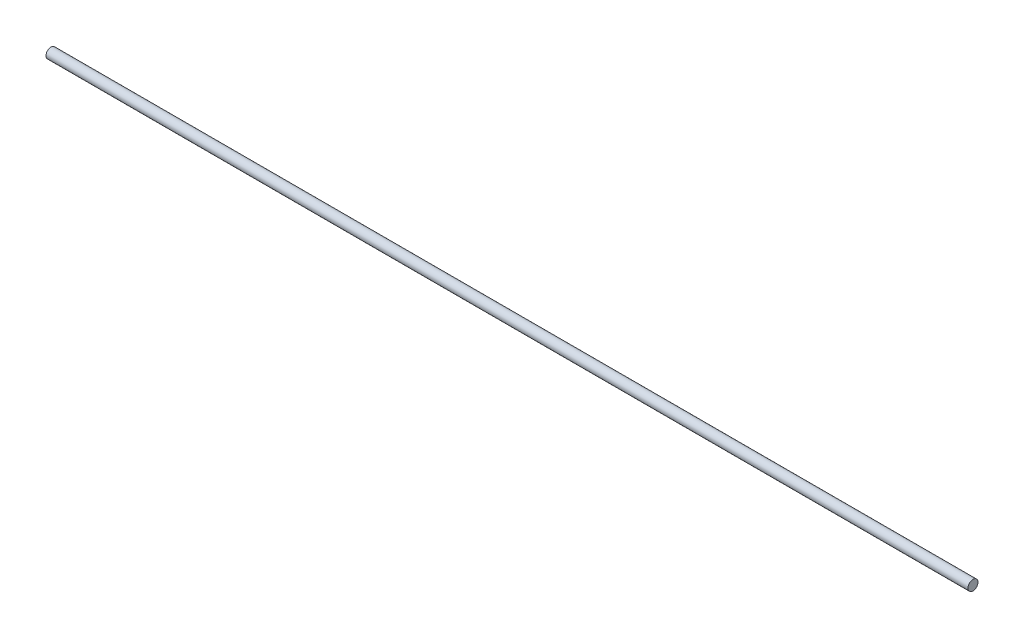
SolidWorks part; units mm, degrees
ref_plane "Front Plane" through (0, 0, 0) normal (1, 0, 0) x (0, 1, 0)
ref_plane "Top Plane" through (0, 0, 0) normal (0, 0, 1) x (0, 1, 0)
ref_plane "Right Plane" through (0, 0, 0) normal (0, 1, 0) x (-1, 0, 0)
sketch "Sketch1" plane through (0, 0, 0) normal (1, 0, 0) x (0, 1, 0)
  circle A0 centre (0, 0) radius 14.3256
  dimension "D1" = 28.6512
extrude "N9 - 2.257in - 8.7ft" add sketch "Sketch1" along normal mid plane 2636.45
ref_plane "6.9in offset 1" through (1143.35, 0, 0) normal (1, 0, 0) x (0, 1, 0)
ref_plane "6.9in offset 2" through (-1143.35, 0, 0) normal (-1, 0, 0) x (0, -1, 0)
